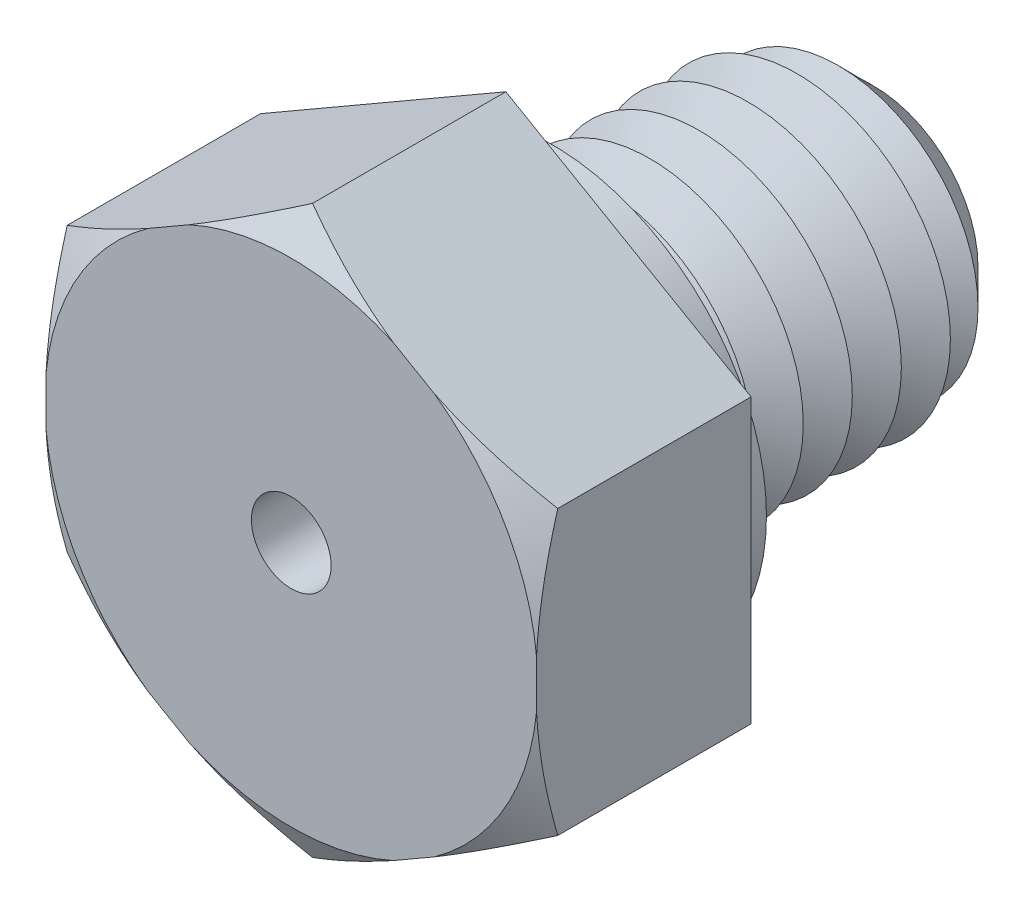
SolidWorks part; units mm, degrees
ref_plane "Front Plane" through (0, 0, 0) normal (0, 0, 1) x (1, 0, 0)
ref_plane "Top Plane" through (0, 0, 0) normal (0, 1, 0) x (1, 0, 0)
ref_plane "Right Plane" through (0, 0, 0) normal (1, 0, 0) x (0, 0, -1)
sketch "Sketch2" plane through (0, 0, 0) normal (0, 0, 1) x (1, 0, 0)
  line L1 (0, 4.6188) -> (-4, 2.3094)
  line L2 (-4, 2.3094) -> (-4, -2.3094)
  line L3 (-4, -2.3094) -> (0, -4.6188)
  line L4 (0, -4.6188) -> (4, -2.3094)
  line L5 (4, -2.3094) -> (4, 2.3094)
  line L6 (4, 2.3094) -> (0, 4.6188)
  circle A0 centre (0, 0) radius 4 construction
  dimension "D1" = 8
extrude "Boss-Extrude1" add sketch "Sketch2" along normal blind 3.5
sketch "Sketch3" plane through (0, 0, 0) normal (0, 0, -1) x (-1, 0, 0)
  circle A0 centre (0, 0) radius 2.5
  dimension "D1" = 5
extrude "Boss-Extrude2" add sketch "Sketch3" along normal blind 6
sketch "Sketch4" plane through (0, 0, 0) normal (0, 0, -1) x (-1, 0, 0)
  circle A0 centre (0, 0) radius 3.5
  dimension "D1" = 7
extrude "Boss-Extrude3" add sketch "Sketch4" along normal blind 0.75
sketch "Sketch5" plane through (0, 0, 0) normal (1, 0, 0) x (0, 0, -1)
  line L0 (-3.2117, 0) -> (6.3192, 0) construction
chamfer "Chamfer1" distance 0.8 angle 45 1 edges at (-2.5, 0, -6)
sketch "Sketch6" plane through (0, 0, 0) normal (1, 0, 0) x (0, 0, -1)
  line L0 (0.75, 2.5) -> (1.15, 1.8072)
  line L1 (1.15, 1.8072) -> (1.55, 2.5)
  line L2 (5.2, 2.5) -> (0.75, 2.5) construction
  line L3 (1.55, 2.5) -> (0.75, 2.5)
  dimension "D1" = 0.8
revolve "Cut-Revolve1" cut sketch "Sketch6" angle 360 about L0
pattern_linear "LPattern1" count 6 spacing 0.8 along (0, 0, -1) of "Cut-Revolve1"
sketch "Sketch7" plane through (0, 0, 0) normal (1, 0, 0) x (0, 0, -1)
  line L0 (-3.5, 4.6188) -> (-3.5, 4.0188)
  line L1 (-3.5, 2.3094) -> (-3.5, 4.6188) construction
  line L2 (-3.5, 4.0188) -> (-3.1536, 4.6188)
  line L3 (-3.5, 4.6188) -> (0, 4.6188) construction
  line L4 (-3.1536, 4.6188) -> (-3.5, 4.6188)
  dimension "D1" = 0.6
  dimension "D2" = 30
revolve "Cut-Revolve2" cut sketch "Sketch7" angle 360 about L0
sketch "Sketch8" plane through (0, 0, 3.5) normal (0, 0, 1) x (1, 0, 0)
  circle A0 centre (0, 0) radius 0.65
  dimension "D1" = 1.3
extrude "Cut-Extrude1" cut sketch "Sketch8" against normal up to surface (9.5 mm away)
